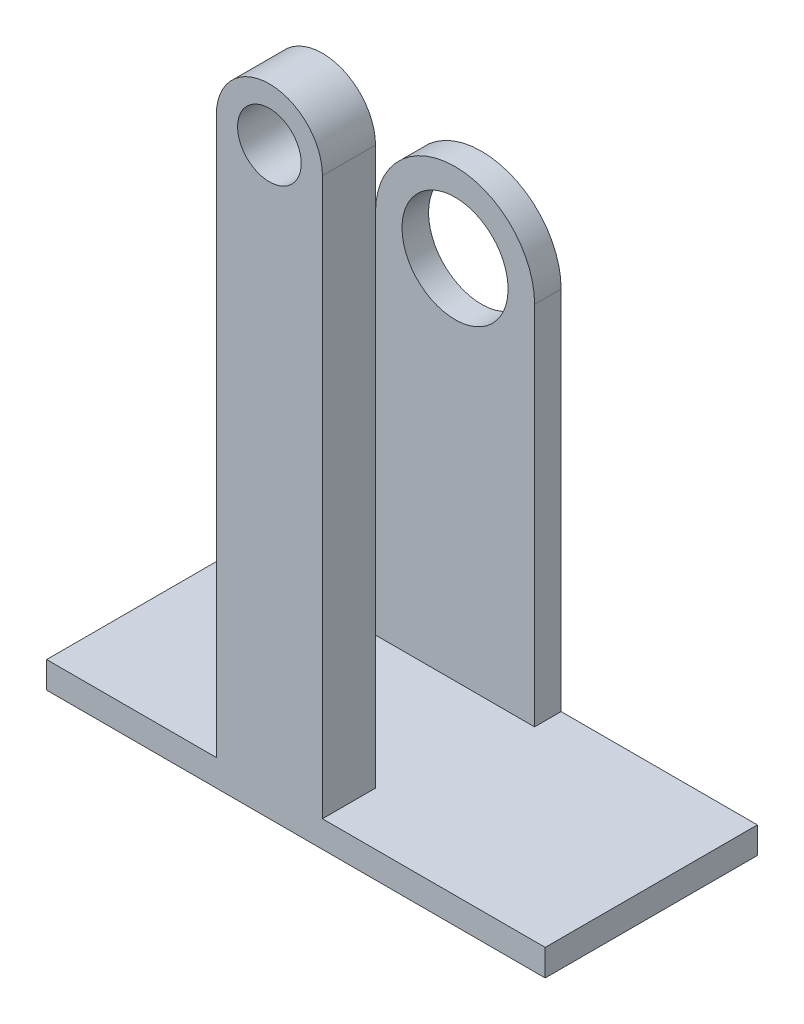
SolidWorks part; units mm, degrees
ref_plane "Face" through (0, 0, 0) normal (0, 0, 1) x (1, 0, 0)
ref_plane "Dessus" through (0, 0, 0) normal (0, 1, 0) x (1, 0, 0)
ref_plane "Droite" through (0, 0, 0) normal (1, 0, 0) x (0, 0, -1)
sketch "Esquisse1" plane through (0, 0, 0) normal (0, 0, 1) x (1, 0, 0)
  line L0 (0, 0) -> (0, 55.9952) construction
  circle A2 centre (0, 36) radius 6
  circle A3 centre (0, 36) radius 10
extrude "Extrusion1" add sketch "Esquisse1" along normal blind 10
sketch "Esquisse5" plane through (0, 0, 10) normal (0, 0, 1) x (1, 0, 0)
  line L0 (0, 36) -> (0, -31.48) construction
  line L1 (-10, 36) -> (-10, -74)
  line L3 (-10, -74) -> (10, -74)
  line L4 (10, -74) -> (10, 36)
  circle A0 centre (0, 36) radius 10 construction
  arc A1 (10, 36) -> (-10, 36) centre (0, 36) cw
extrude "Extrusion6" add sketch "Esquisse5" against normal blind 10
sketch "Esquisse6" plane through (0, 0, 10) normal (0, 0, 1) x (1, 0, 0)
  line L0 (0, 36) -> (0, -77.9338) construction
  line L2 (-42, -74) -> (52, -74)
  line L3 (-42, -74) -> (-42, -69)
  line L4 (-42, -69) -> (52, -69)
  line L5 (52, -74) -> (52, -69)
  dimension "D1" = 42
  dimension "D2" = 94
  dimension "D3" = 5
extrude "Extrusion7" add sketch "Esquisse6" against normal blind 40
sketch "Esquisse7" plane through (0, 0, -30) normal (0, 0, -1) x (-1, 0, 0)
  line L0 (-15, 0) -> (-15, -74)
  line L1 (42, -74) -> (-52, -74) construction
  line L2 (15, 0) -> (15, -74)
  line L3 (15, -74) -> (-15, -74)
  circle A0 centre (0, 0) radius 10
  arc A1 (15, 0) -> (-15, 0) centre (0, 0) ccw
extrude "Extrusion8" add sketch "Esquisse7" against normal blind 5
